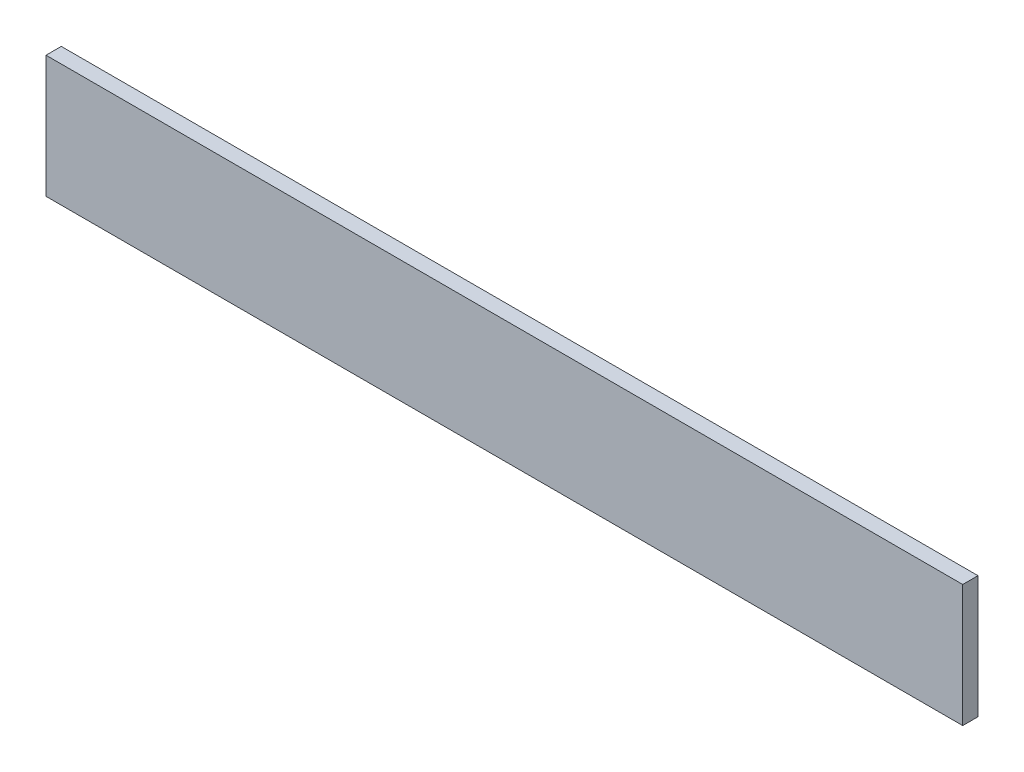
SolidWorks part; units mm, degrees
ref_plane "Front Plane" through (0, 0, 0) normal (0, 0, 1) x (1, 0, 0)
ref_plane "Top Plane" through (0, 0, 0) normal (0, 1, 0) x (1, 0, 0)
ref_plane "Right Plane" through (0, 0, 0) normal (1, 0, 0) x (0, 0, -1)
sketch "Sketch1" plane through (0, 0, 0) normal (0, 0, 1) x (1, 0, 0)
  line L1 (-181.4301, 71.0219) -> (580.5699, 71.0219)
  line L2 (-181.4301, 71.0219) -> (-181.4301, -30.5781)
  line L3 (-181.4301, -30.5781) -> (580.5699, -30.5781)
  line L4 (580.5699, 71.0219) -> (580.5699, -30.5781)
  dimension "D1" = 762
  dimension "D2" = 101.6
extrude "Extrude1" add sketch "Sketch1" along normal blind 12.7
